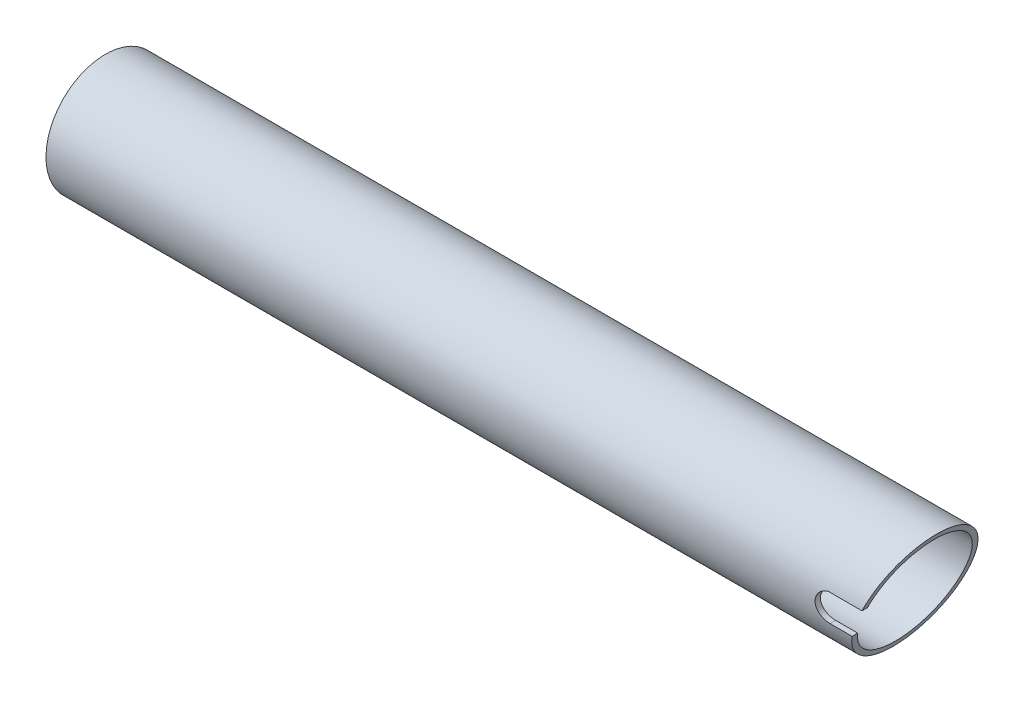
SolidWorks part; units mm, degrees
ref_plane "Plan de face" through (0, 0, 0) normal (0, 0, 1) x (1, 0, 0)
ref_plane "Plan de dessus" through (0, 0, 0) normal (0, 1, 0) x (1, 0, 0)
ref_plane "Plan de droite" through (0, 0, 0) normal (1, 0, 0) x (0, 0, -1)
sketch "Esquisse1" plane through (0, 0, 0) normal (1, 0, 0) x (0, 0, -1)
  circle A0 centre (0, 0) radius 11
  dimension "D1" = 22
extrude "Extru.-Mince1" add sketch "Esquisse1" along normal blind 160 thin
sketch "Esquisse2" plane through (0, 0, 0) normal (0, 0, 1) x (1, 0, 0)
  line L0 (154.0037, 11) -> (145.9963, -11)
  line L1 (160, 11) -> (0, 11) construction
  line L2 (0, -11) -> (160, -11) construction
  line L3 (-3.515, 0) -> (176.7095, 0) construction
  line L5 (0, 11) -> (0, -11) construction
  point P13 (150, 0)
  dimension "D1" = 150
  dimension "D2" = 70
extrude "Enlèv. mat.-Extru.1" cut sketch "Esquisse2" against normal through all and the other way through all
sketch "Esquisse3" plane through (0, 0, 0) normal (0, 0, 1) x (1, 0, 0)
  line L0 (150.9099, 2.5) -> (145, 2.5)
  line L1 (145.9963, -11) -> (154.0037, 11) construction
  line L2 (145, -2.5) -> (149.0901, -2.5)
  line L3 (149.0901, -2.5) -> (150.9099, 2.5)
  arc A0 (145, 2.5) -> (145, -2.5) centre (145, 0) ccw
  point P6 (150, 0)
  dimension "D1" = 2.5
  dimension "D2" = 5
extrude "Enlèv. mat.-Extru.2" cut sketch "Esquisse3" along normal through all
